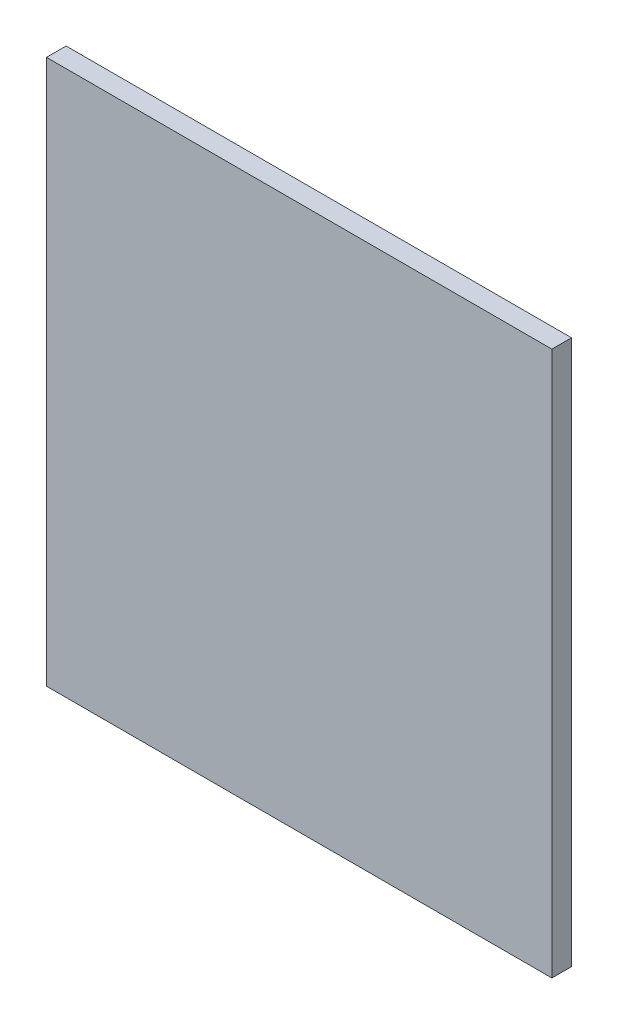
SolidWorks part; units mm, degrees
ref_plane "前视基准面" through (0, 0, 0) normal (0, 0, 1) x (1, 0, 0)
ref_plane "上视基准面" through (0, 0, 0) normal (0, 1, 0) x (1, 0, 0)
ref_plane "右视基准面" through (0, 0, 0) normal (1, 0, 0) x (0, 0, -1)
other "Configuration Table"
sketch "草图1" plane through (0, 0, 0) normal (0, 0, 1) x (1, 0, 0)
  line L0 (-50, -61) -> (53, -61)
  line L1 (53, -61) -> (53, 50)
  line L2 (53, 50) -> (-50, 50)
  line L3 (-50, 50) -> (-50, -61)
  dimension "D1" = 53
  dimension "D2" = 50
  dimension "D3" = 50
  dimension "D4" = 61
extrude "Single_common_plane_Z0" add sketch "草图1" along normal blind 4 from offset 4
